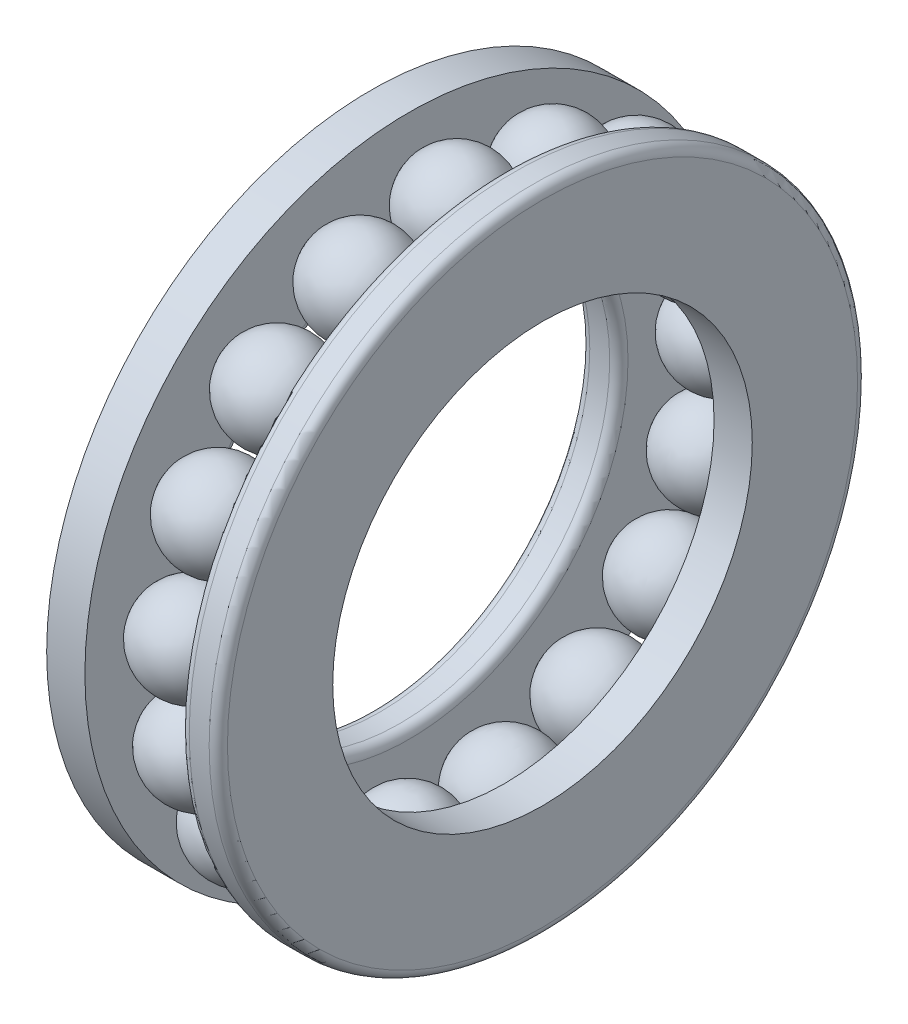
SolidWorks part; units mm, degrees
ref_plane "Plane1" through (0, 0, 0) normal (0, 0, 1) x (1, 0, 0)
ref_plane "Plane2" through (0, 0, 0) normal (0, 1, 0) x (1, 0, 0)
ref_plane "Plane3" through (0, 0, 0) normal (1, 0, 0) x (0, 0, -1)
sketch "Clipboard" plane through (0, 0, 0) normal (0, 0, 1) x (1, 0, 0)
  line L0 (-10, 0) -> (10, 0) construction
  line L1 (0, 0) -> (21.3836, -6.5376)
  line L2 (0, 0) -> (27.3662, 35.0271)
  line L3 (0, 0) -> (13.7666, -17.6205)
  line L4 (0, 0) -> (-22.3471, -0.7804)
  dimension "BallCLRad" = 44.45
  dimension "Count" = 52
  dimension "Show_count" = 52
  dimension "Max_count" = 17
  dimension "Min_count" = 2
sketch "InnRacSke" plane through (0, 0, 0) normal (0, 0, 1) x (1, 0, 0)
  line L1 (-7.9248, 34.925) -> (-14.2875, 34.925)
  line L2 (-14.2875, 34.925) -> (-14.2875, 53.975)
  line L3 (-14.2875, 53.975) -> (-7.9248, 53.975)
  line L4 (-7.9248, 53.975) -> (-7.9248, 34.925)
  line L5 (-34.925, 0) -> (34.925, 0) construction
  line L6 (0, 0) -> (0, 25.4) construction
  dimension "ID" = 69.85
  dimension "OD" = 107.95
  dimension "Width" = 28.575
  dimension "gap" = 15.8496
revolve "Race" add sketch "InnRacSke" angle 360 about L5
ref_axis "Axis1" through (-50, 0, 0) along (1, 0, 0)
sketch "BalDetSke" plane through (0, 0, 0) normal (0, 0, 1) x (1, 0, 0)
  line L0 (-7.9375, 44.45) -> (7.9375, 44.45)
  line L1 (-14.5732, 44.45) -> (14.5732, 44.45) construction
  arc A0 (7.9375, 44.45) -> (-7.9375, 44.45) centre (0, 44.45) cw
  dimension "Ball_diameter" = 15.875
  dimension "BallCLRad" = 44.45
revolve "BallDetailed" add sketch "BalDetSke" angle 360 about L1
sketch "BalSimSke" plane through (0, 0, 0) normal (0, 0, 1) x (1, 0, 0)
  line L0 (-25.4, 0) -> (25.4, 0) construction
  circle A0 centre (0, 44.45) radius 7.9375
  dimension "Ball_diameter" = 15.875
  dimension "BallCLRad" = 44.45
revolve "BallsSimplified" [suppressed] add sketch "BalSimSke" angle 360 about L0
mirror "Mirror1" about plane through (0, 0, 0) normal (1, 0, 0) of "Race"
fillet "Fillet" radius 1.524 4 edges at (7.9248, 0, -53.975) (14.2875, 0, -53.975) (-7.9248, 0, -34.925) (-14.2875, 0, -34.925)
pattern_circular "BallsDetailed" count 17 every 21.176 about axis through (-50, 0, 0) along (1, 0, 0) of "BallDetailed"
sketch "CagSpiSke" plane through (0, 0, 0) normal (0, 0, 1) x (1, 0, 0)
  line L0 (1.9844, 35.7188) -> (1.9844, 53.1812)
  line L1 (1.9844, 53.1812) -> (-1.2169, 53.1812)
  line L2 (-1.2169, 53.1812) -> (-1.2169, 35.7188)
  line L3 (-1.2169, 35.7188) -> (1.9844, 35.7188)
  line L4 (-34.925, 0) -> (34.925, 0) construction
  line L5 (0, 0) -> (0, 50.8) construction
  dimension "Thickness" = 3.9688
  dimension "ID" = 71.4375
  dimension "OD" = 106.3625
revolve "CageSpine" [suppressed] add sketch "CagSpiSke" angle 360 about L4
equation "\"BallCLRad@Clipboard\" =  ( \"OD@InnRacSke\" + \"ID@InnRacSke\" )  / 4"
equation "\"BallCLRad@BalSimSke\" = \"BallCLRad@Clipboard\""
equation "\"BallCLRad@BalDetSke\" = \"BallCLRad@Clipboard\""
equation "\"gap@InnRacSke\" = \"Ball_diameter@BalDetSke\" - 0.001"
equation "\"Ball_diameter@BalSimSke\" = \"Ball_diameter@BalDetSke\""
equation "\"Max_count@Clipboard\" = int( 3.14159265 / atn(( \"Ball_diameter@BalDetSke\" / 2) / sqr( \"BallCLRad@Clipboard\"  *  \"BallCLRad@Clipboard\" - ( \"Ball_diameter@BalDetSke\" / 2) *  ( \"Ball_diameter@BalDetSke\" "
equation "\"Max_count@Clipboard\" = ((sgn( \"Max_count@Clipboard\" - \"Count@Clipboard\" )-1)*( \"Max_count@Clipboard\" - \"Count@Clipboard\" ))/-2+ \"Count@Clipboard\""
equation "\"Count@BallsDetailed\" = int( \"Show_count@Clipboard\" ) "
equation "\"Count@BallsDetailed\" = ((sgn( \"Count@BallsDetailed\" - \"Max_count@Clipboard\" )-1)*( \"Count@BallsDetailed\" - \"Max_count@Clipboard\" ))/-2+ \"Max_count@Clipboard\""
equation "\"Count@BallsDetailed\" = ((sgn( \"Count@BallsDetailed\" - \"Min_count@Clipboard\" )+1)*( \"Count@BallsDetailed\" - \"Min_count@Clipboard\"))/2 +\"Min_count@Clipboard\""
equation "\"Angle@BallsDetailed\" = 360.0 / \"Max_count@Clipboard\""
equation "\"Angle@CageSpine\" =  \"Angle@BallsDetailed\" * ( \"Count@BallsDetailed\" -1 + int( \"Count@BallsDetailed\" / \"Max_count@Clipboard\" ) )  + 0.001 -  int( \"Count@BallsDetailed\" / \"Max_count@Clipboard\" ) * 0.00"
equation "\"Angle@CageSpine\" =  \"Angle@CageSpine\" * int( \"Min_count@Clipboard\" / 2) + int(1 / \"Min_count@Clipboard\")  * 0.001"
equation "\"Thickness@CagSpiSke\" =  \"Ball_diameter@BalDetSke\" * 0.25"
equation "\"OD@CagSpiSke\" = ( \"OD@InnRacSke\" + ( \"BallCLRad@Clipboard\" * 2 + \"Ball_diameter@BalDetSke\" )) / 2"
equation "\"ID@CagSpiSke\" = ( \"ID@InnRacSke\" + ( \"BallCLRad@Clipboard\" * 2 - \"Ball_diameter@BalDetSke\" )) / 2"
